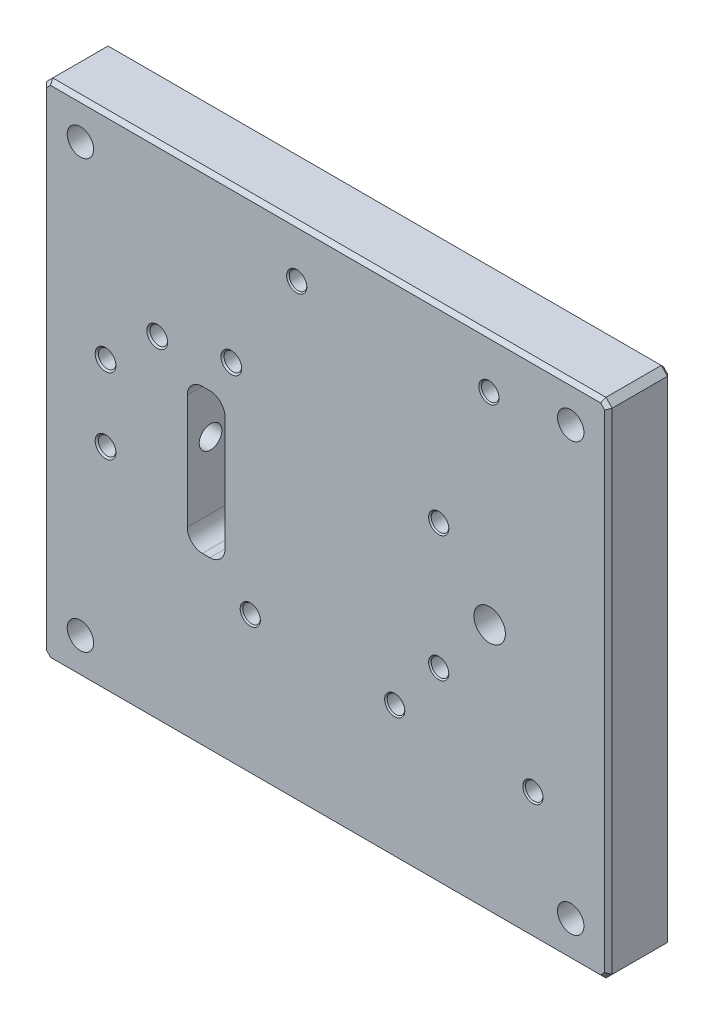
SolidWorks part; units mm, degrees
ref_plane "Plan de face" through (0, 0, 0) normal (0, 0, 1) x (1, 0, 0)
ref_plane "Plan de dessus" through (0, 0, 0) normal (0, 1, 0) x (1, 0, 0)
ref_plane "Plan de droite" through (0, 0, 0) normal (1, 0, 0) x (0, 0, -1)
sketch "Esquisse1" plane through (0, -20, 0) normal (0, 0, -1) x (1, 0, 0)
  line L0 (-280, -215) -> (-275, -220)
  line L1 (-275, -220) -> (165, -220)
  line L2 (165, -220) -> (170, -215)
  line L3 (170, -215) -> (170, 175)
  line L4 (170, 175) -> (165, 180)
  line L5 (165, 180) -> (-275, 180)
  line L6 (-275, 180) -> (-280, 175)
  line L7 (-280, 175) -> (-280, -215)
  circle A0 centre (-250, 150) radius 10.5
  circle A1 centre (140, 150) radius 10.5
  circle A2 centre (-250, -190) radius 10.5
  circle A3 centre (140, -190) radius 10.5
  dimension "D5" = 21
  dimension "D6" = 21
  dimension "D7" = 21
  dimension "D8" = 21
  dimension "D3" = 30
  dimension "D4" = 30
  dimension "D9" = 5
  dimension "D10" = 225
  dimension "D11" = 5
  dimension "D12" = 225
  dimension "D13" = 5
  dimension "D14" = 225
  dimension "D15" = 225
  dimension "D16" = 5
  dimension "D17" = 30
  dimension "D18" = 30
  dimension "D19" = 280
  dimension "D20" = 200
  dimension "D26" = 170
  dimension "D27" = 200
extrude "Volume" add sketch "Esquisse1" along normal blind 50
sketch "Positions taraudages M16 ponctuelles" plane through (0, 0, 0) normal (0, 0, 1) x (1, 0, 0)
  point P0 (35, 50)
  point P1 (35, -50)
  dimension "D1" = 50
  dimension "D2" = 50
  dimension "D3" = 35
hole_wizard "Trous taraudés M16 ponctuelles" positions "Esquisse3D3" profile "Esquisse10" tap size "M16" standard "DIN"
sketch3d "Esquisse3D3"
  point P0 (35, 50, 0)
  point P3 (35, -50, 0)
sketch "Esquisse10" plane through (35, 50, 0) normal (1, 0, 0) x (0, -1, 0)
  line L0 (0, 0) -> (0, 39.206)
  line L1 (0, 39.206) -> (7, 35)
  line L2 (7, 35) -> (7, 1.025)
  line L3 (7, 1.025) -> (8.025, 0)
  line L5 (8.025, 0) -> (0, 0)
  line L6 (-7, 1.025) -> (-8.025, 0) construction
  line L10 (0, 39.206) -> (-7, 35) construction
  line L11 (0, -6.35) -> (0, 107.95) construction
  dimension "Diamètre du trou pour taraudage" = 14
  dimension "Profondeur du trou pour taraudage" = 35
  dimension "Diamètre du fraisage entrant" = 16.05
  dimension "Angle du fraisage entrant" = 90
  dimension "Angle de pointe" = 118
sketch "Cimblot - Position chambrage M16" plane through (0, 0, 0) normal (0, 0, 1) x (1, 0, 0)
  point P0 (75.502, 0)
  dimension "D1" = 75.502
hole_wizard "Cimblot - Chambrage vis M16" positions "Esquisse24" profile "Esquisse23" counterbore size "M16" standard "ISO"
sketch "Esquisse24" plane through (0, 0, -50) normal (0, 0, -1) x (-1, 0, 0)
  point P0 (-75.502, 0)
sketch "Esquisse23" plane through (75.502, 0, -50) normal (1, 0, 0) x (0, 1, 0)
  line L0 (0, 0) -> (0, 50)
  line L1 (8.75, 49.75) -> (9, 50)
  line L2 (13, 16) -> (8.75, 16)
  line L3 (8.75, 16) -> (8.75, 49.75)
  line L5 (13, 16) -> (13, 0.75)
  line L6 (13, 0.75) -> (13.75, 0)
  line L7 (13.75, 0) -> (0, 0)
  line L8 (-13, 0.75) -> (-13.75, 0) construction
  line L11 (0, -6.35) -> (0, 107.95) construction
  line L12 (9, 50) -> (0, 50)
  line L13 (-8.75, 49.75) -> (-9, 50) construction
  dimension "Diamètre du perçage jusqu'au prochain" = 17.5
  dimension "Profondeur du perçage jusqu'au prochain" = 50
  dimension "Diamètre du chambrage" = 26
  dimension "Profondeur du chambrage" = 16
  dimension "Diamètre du fraisage entrant" = 27.5
  dimension "Angle du fraisage entrant" = 90
  dimension "Diamètre du fraisage débouchant" = 18
  dimension "Angle du fraisage débouchant" = 90
sketch "Esquisse25" plane through (0, 0, 0) normal (0, 0, 1) x (1, 0, 0)
  circle A0 centre (75.502, 0) radius 12.5
  dimension "D1" = 25
extrude "Cimblot - Lamage " cut sketch "Esquisse25" against normal blind 18
sketch "Esquisse18" plane through (0, 0, 0) normal (0, 0, 1) x (1, 0, 0)
  line L1 (-153, 50) -> (-147, 50)
  line L2 (-165, 38) -> (-165, -53)
  line L3 (-153, -65) -> (-147, -65)
  line L4 (-135, 38) -> (-135, -53)
  arc A0 (-165, -53) -> (-153, -65) centre (-153, -53) ccw
  arc A1 (-147, -65) -> (-135, -53) centre (-147, -53) ccw
  arc A2 (-147, 50) -> (-135, 38) centre (-147, 38) cw
  arc A3 (-153, 50) -> (-165, 38) centre (-153, 38) ccw
  point P11 (-135, 50)
  point P14 (-165, 50)
  dimension "D5" = 12
  dimension "D1" = 50
  dimension "D2" = 135
  dimension "D3" = 30
  dimension "D4" = 65
  dimension "D6" = 91
extrude "Logement palonnier" cut sketch "Esquisse18" against normal blind 38
sketch "Position axe palonnier" plane through (-280, 0, 0) normal (-1, 0, 0) x (0, 0, 1)
  line L2 (0, -195) -> (0, 195) construction
  point P0 (-18.5, 0)
  dimension "D1" = 18.5
hole_wizard "Axe palonnier perçage Ø17.5" positions "Esquisse3D4" profile "Esquisse14" hole size "Ø17.5" standard "ISO"
sketch3d "Esquisse3D4"
  point P0 (-280, 0, -18.5)
sketch "Esquisse14" plane through (-280, 0, -18.5) normal (0, 1, 0) x (0, 0, 1)
  line L0 (0, 0) -> (0, 175.2575)
  line L1 (0, 175.2575) -> (8.75, 170)
  line L2 (8.75, 170) -> (8.75, 0)
  line L5 (8.75, 0) -> (0, 0)
  line L10 (0, 175.2575) -> (-8.75, 170) construction
  line L11 (0, -6.35) -> (0, 107.95) construction
  dimension "Diamètre du perçage" = 17.5
  dimension "Profondeur du perçage" = 170
  dimension "Angle de pointe" = 118
sketch "Esquisse15" plane through (-280, 0, 0) normal (-1, 0, 0) x (0, 0, 1)
  circle A0 centre (-18.5, 0) radius 9
  dimension "D1" = 18
extrude "Axe plonnier alésage Ø18" cut sketch "Esquisse15" against normal blind 40 and the other way through all from surface at -145
sketch "Positions taraudages M16 pré-positionneur" plane through (0, 0, 0) normal (0, 0, 1) x (1, 0, 0)
  line L0 (-140.7833, -86.8732) -> (131.6879, -98.731) construction
  line L1 (-101.515, 0) -> (40.0524, 0) construction
  point P0 (0, -93)
  point P1 (-114.8913, -88)
  point P7 (109.896, -97.7826)
  dimension "D1" = 93
  dimension "D2" = 115
  dimension "D3" = 88
  dimension "D4" = 110
hole_wizard "Taraudages M16 pré-positionneur" positions "Esquisse3D6" profile "Esquisse20" tap size "M16" standard "DIN"
sketch3d "Esquisse3D6"
  point P0 (-114.8913, -88, 0)
  point P3 (0, -93, 0)
  point P6 (109.896, -97.7826, 0)
sketch "Esquisse20" plane through (-114.8913, -88, 0) normal (1, 0, 0) x (0, -1, 0)
  line L0 (0, 0) -> (0, 46.206)
  line L1 (0, 46.206) -> (7, 42)
  line L2 (7, 42) -> (7, 1.025)
  line L3 (7, 1.025) -> (8.025, 0)
  line L5 (8.025, 0) -> (0, 0)
  line L6 (-7, 1.025) -> (-8.025, 0) construction
  line L10 (0, 46.206) -> (-7, 42) construction
  line L11 (0, -6.35) -> (0, 107.95) construction
  dimension "Diamètre du trou pour taraudage" = 14
  dimension "Profondeur du trou pour taraudage" = 42
  dimension "Diamètre du fraisage entrant" = 16.05
  dimension "Angle du fraisage entrant" = 90
  dimension "Angle de pointe" = 118
sketch "Positions taraudages M16 goujons brides" plane through (0, 0, 0) normal (0, 0, 1) x (1, 0, 0)
  line L0 (-140.7833, -86.8732) -> (131.6879, -98.731) construction
  point P0 (-77.9262, 160)
  point P1 (74.9291, 160)
  point P3 (-77.9262, -89.6087)
  point P4 (74.9291, -96.2609)
  dimension "D1" = 160
  dimension "D4" = 78
  dimension "D5" = 75
hole_wizard "Trous taraudés M16 - brides" positions "Esquisse3D7" profile "Esquisse22" tap size "M16" standard "DIN"
sketch3d "Esquisse3D7"
  point P0 (-77.9262, 160, 0)
  point P3 (74.9291, 160, 0)
sketch "Esquisse22" plane through (-77.9262, 160, 0) normal (1, 0, 0) x (0, -1, 0)
  line L0 (0, 0) -> (0, 46.206)
  line L1 (0, 46.206) -> (7, 42)
  line L2 (7, 42) -> (7, 1.025)
  line L3 (7, 1.025) -> (8.025, 0)
  line L5 (8.025, 0) -> (0, 0)
  line L6 (-7, 1.025) -> (-8.025, 0) construction
  line L10 (0, 46.206) -> (-7, 42) construction
  line L11 (0, -6.35) -> (0, 107.95) construction
  dimension "Diamètre du trou pour taraudage" = 14
  dimension "Profondeur du trou pour taraudage" = 42
  dimension "Diamètre du fraisage entrant" = 16.05
  dimension "Angle du fraisage entrant" = 90
  dimension "Angle de pointe" = 118
sketch "Positions taraudages M16 - Supports serrage" plane through (0, 0, 0) normal (0, 0, 1) x (1, 0, 0)
  line L0 (-198.6476, 64.6189) -> (-105.1912, 82.8358) construction
  line L1 (-188.6476, 0) -> (37.4659, 0) construction
  line L2 (-230, 50) -> (-230, -57.3238) construction
  point P6 (-130, 78)
  point P7 (-188.8916, 66.5206)
  point P9 (-230, 30)
  point P10 (-230, -30)
  dimension "D1" = 11.03
  dimension "D2" = 60
  dimension "D3" = 130
  dimension "D4" = 78
  dimension "D5" = 30
  dimension "D6" = 60
  dimension "D7" = 230
hole_wizard "Trou taraudé M16 - Supports serrage" positions "Esquisse29" profile "Esquisse28" tap size "M16" standard "DIN"
sketch "Esquisse29" plane through (0, 0, 0) normal (0, 0, 1) x (1, 0, 0)
  point P0 (-230, 30)
  point P1 (-130, 78)
  point P4 (-188.8916, 66.5206)
  point P7 (-230, -30)
sketch "Esquisse28" plane through (-230, 30, 0) normal (1, 0, 0) x (0, -1, 0)
  line L0 (0, 0) -> (0, 44.206)
  line L1 (0, 44.206) -> (7, 40)
  line L2 (7, 40) -> (7, 1.25)
  line L3 (7, 1.25) -> (8.25, 0)
  line L5 (8.25, 0) -> (0, 0)
  line L6 (-7, 1.25) -> (-8.25, 0) construction
  line L10 (0, 44.206) -> (-7, 40) construction
  line L11 (0, -6.35) -> (0, 107.95) construction
  dimension "Diamètre du trou pour taraudage" = 14
  dimension "Profondeur du trou pour taraudage" = 40
  dimension "Diamètre du fraisage entrant" = 16.5
  dimension "Angle du fraisage entrant" = 90
  dimension "Angle de pointe" = 118
chamfer "Chanfrein1" distance 3 angle 45 16 edges at (-277.5, 197.5, -50) (-280, 0, -50) (-277.5, -197.5, -50) (-55, -200, -50) (167.5, -197.5, -50) (-55, 200, -50) (170, 0, -50) (167.5, 197.5, -50) (167.5, 197.5, 0) (170, 0, 0) (167.5, -197.5, 0) (-55, -200, 0) (-277.5, -197.5, 0) (-280, 0, 0) (-277.5, 197.5, 0) (-55, 200, 0)
sketch "Axe pour assemblage" plane through (0, 0, 0) normal (0, 1, 0) x (1, 0, 0)
  line L0 (0, 19.2108) -> (0, -137.9966) construction
